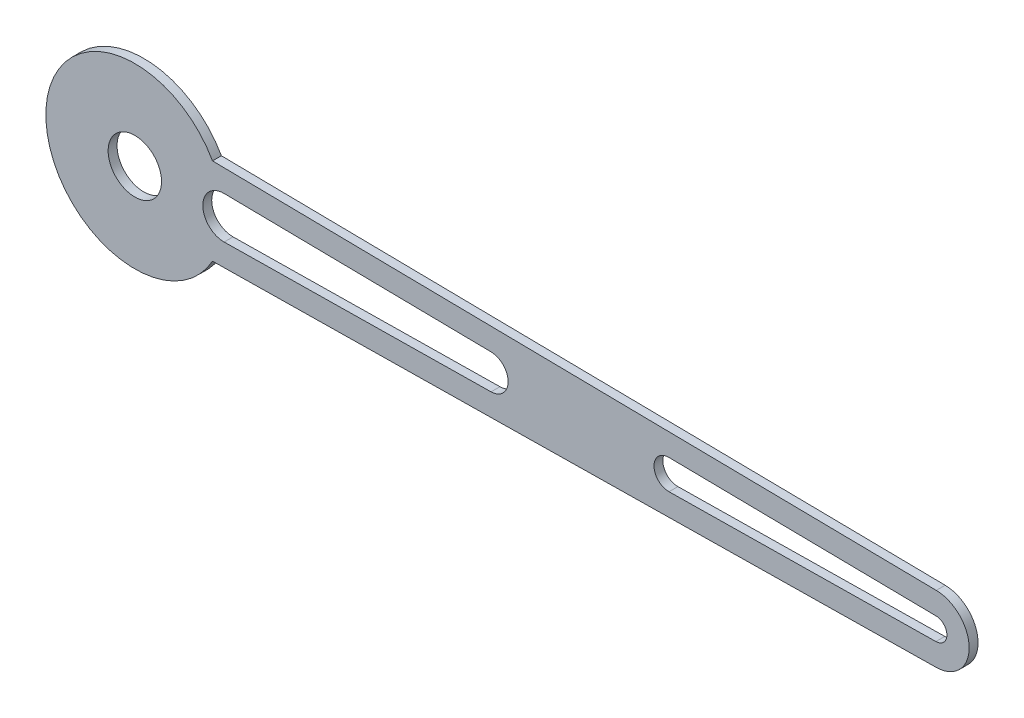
SolidWorks part; units mm, degrees
ref_plane "Front" through (0, 0, 0) normal (0, 0, 1) x (1, 0, 0)
ref_plane "Top" through (0, 0, 0) normal (0, 1, 0) x (1, 0, 0)
ref_plane "Right" through (0, 0, 0) normal (1, 0, 0) x (0, 0, -1)
sketch "Sketch1" plane through (0, 0, 0) normal (0, 0, 1) x (1, 0, 0)
  line L0 (-19.6851, 0) -> (20.2961, 0) construction
  line L1 (0, 17.3189) -> (0, -16.8635) construction
  circle A0 centre (10, 0) radius 1.75 construction
  circle A1 centre (-7.5, 0) radius 4 construction
  circle A2 centre (0, 7.5) radius 4 construction
  circle A3 centre (0, -7.5) radius 4 construction
  point P12 (0, 0)
  dimension "D1" = 8
  dimension "D2" = 8
  dimension "D3" = 8
  dimension "D4" = 3.5
  dimension "D5" = 10
  dimension "D6" = 7.5
  dimension "D7" = 7.5
  dimension "D8" = 7.5
sketch "Sketch3" plane through (0, 0, 0) normal (0, 0, 1) x (1, 0, 0)
  line L1 (0.3749, 13.0072) -> (0.6099, 0.7925) construction
  line L2 (-0.3749, 13.0072) -> (-0.6099, 0.7925) construction
  line L3 (0.125, 13.0024) -> (0.2211, 8.0043) construction
  line L4 (-0.125, 13.0024) -> (-0.2211, 8.0043) construction
  line L5 (-0.2788, 5.0054) -> (-0.3557, 1.0068) construction
  line L6 (0.2788, 5.0054) -> (0.3557, 1.0068) construction
  arc A0 (-0.3557, 1.0068) -> (0.3557, 1.0068) centre (0, 1) ccw construction
  arc A1 (0.3749, 13.0072) -> (-0.3749, 13.0072) centre (0, 13) ccw construction
  arc A2 (-0.6099, 0.7925) -> (0.6099, 0.7925) centre (0, 0) ccw construction
  circle A3 centre (0, 0) radius 0.5 construction
  arc A4 (0.125, 13.0024) -> (-0.125, 13.0024) centre (0, 13) ccw construction
  arc A5 (0.2788, 5.0054) -> (-0.2788, 5.0054) centre (0, 5) ccw construction
  arc A6 (-0.2211, 8.0043) -> (0.2211, 8.0043) centre (0, 8) ccw construction
  dimension "D4" = 0.25
sketch "Sketch4" plane through (0, 0, 0) normal (0, 0, 1) x (1, 0, 0)
  line L0 (-19.6851, 0) -> (20.2961, 0) construction
  line L1 (0.8729, 0.4879) -> (9.0052, 0.375)
  line L2 (0.8729, -0.4879) -> (9.0052, -0.375)
  line L3 (1.0033, 0.2361) -> (4.0027, 0.1944)
  line L4 (1.0033, -0.2361) -> (4.0027, -0.1944)
  line L5 (6.0023, -0.1667) -> (9.0017, -0.125)
  line L6 (6.0023, 0.1667) -> (9.0017, 0.125)
  arc A2 (9.0017, -0.125) -> (9.0017, 0.125) centre (9, 0) ccw
  arc A3 (0.8729, 0.4879) -> (0.8729, -0.4879) centre (0, 0) ccw
  arc A4 (4.0027, -0.1944) -> (4.0027, 0.1944) centre (4, 0) ccw
  arc A5 (9.0052, -0.375) -> (9.0052, 0.375) centre (9, 0) ccw
  arc A7 (1.0033, 0.2361) -> (1.0033, -0.2361) centre (1, 0) ccw
  arc A8 (6.0023, 0.1667) -> (6.0023, -0.1667) centre (6, 0) ccw
  circle A9 centre (0, 0) radius 0.3
  dimension "D1" = 9
  dimension "D2" = 3
  dimension "D3" = 0.75
  dimension "D4" = 0.25
  dimension "D5" = 4
  dimension "D6" = 3
extrude "Base-Extrude" add sketch "Sketch4" along normal blind 0.1
